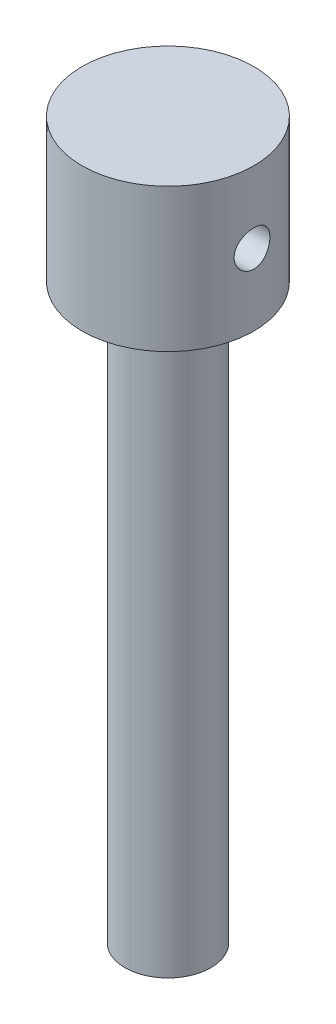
SolidWorks part; units mm, degrees
ref_plane "Front Plane" through (0, 0, 0) normal (0, 0, 1) x (1, 0, 0)
ref_plane "Top Plane" through (0, 0, 0) normal (0, 1, 0) x (1, 0, 0)
ref_plane "Right Plane" through (0, 0, 0) normal (1, 0, 0) x (0, 0, -1)
sketch "Sketch1" plane through (0, 0, 0) normal (0, 1, 0) x (1, 0, 0)
  circle A0 centre (0, 0) radius 12
  dimension "D1" = 24
extrude "Extrude1" add sketch "Sketch1" along normal blind 20
sketch "Sketch2" plane through (0, 0, 0) normal (0, 1, 0) x (1, 0, 0)
  circle A0 centre (0, 0) radius 6
  dimension "D1" = 12
extrude "Extrude2" add sketch "Sketch2" against normal blind 80
ref_plane "Plane1" through (20, 0, 0) normal (1, 0, 0) x (0, 0, -1)
sketch "Sketch4" plane through (20, 0, 0) normal (1, 0, 0) x (0, 0, -1)
  line L0 (12, 20) -> (-12, 20) construction
  line L1 (0, 0) -> (0, 37.218) construction
  circle A0 centre (0, 10) radius 2.5
  dimension "D2" = 5
  dimension "D1" = 10
extrude "Cut-Extrude1" cut sketch "Sketch4" against normal through all
